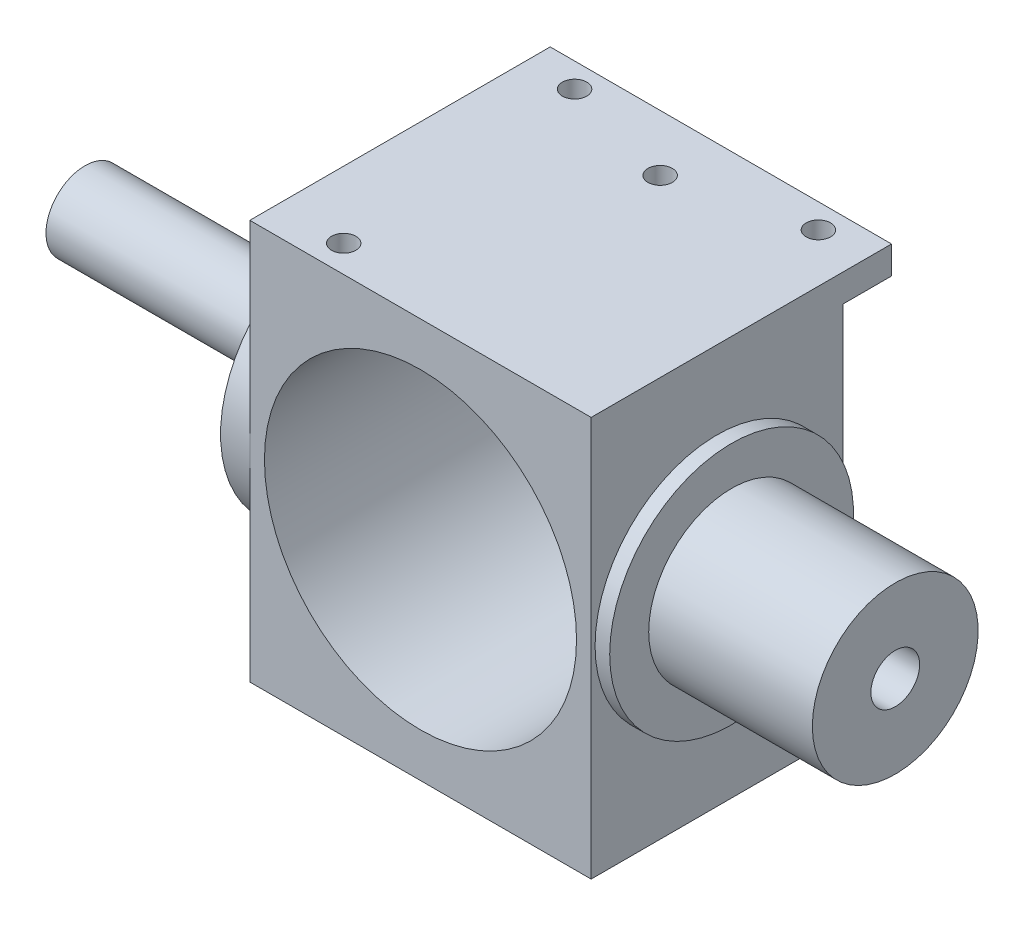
SolidWorks part; units mm, degrees
ref_plane "Front Plane" through (0, 0, 0) normal (0, 0, 1) x (1, 0, 0)
ref_plane "Top Plane" through (0, 0, 0) normal (0, 1, 0) x (1, 0, 0)
ref_plane "Right Plane" through (0, 0, 0) normal (1, 0, 0) x (0, 0, -1)
ref_plane "Plane3" through (0, 0, 37.7129) normal (0, 0, 1) x (1, 0, 0)
sketch "Sketch19" plane through (0, 0, 37.7129) normal (0, 0, 1) x (1, 0, 0)
  line L0 (-29.5005, 31.6184) -> (-29.5005, 27.6184)
  line L1 (-29.5005, 27.6184) -> (0.2995, 27.6184)
  line L2 (0.2995, 27.6184) -> (0.2995, 40.5184)
  line L3 (0.2995, 40.5184) -> (-2.7005, 40.5184)
  line L4 (-2.7005, 40.5184) -> (-2.7005, 33.1184)
  line L5 (-2.7005, 33.1184) -> (-4.2005, 31.6184)
  line L6 (-4.2005, 31.6184) -> (-29.5005, 31.6184)
  line L7 (-29.5005, 27.6184) -> (0.2995, 27.6184) construction
revolve "Revolve2" add sketch "Sketch19" angle 360 about L1
ref_plane "Plane4" through (0, 0, 19.8129) normal (0, 0, -1) x (-1, 0, 0)
sketch "Sketch24" plane through (0, 0, 19.8129) normal (0, 0, -1) x (-1, 0, 0)
  line L0 (-0.2995, 48.1184) -> (-35.2995, 48.1184)
  line L1 (-35.2995, 48.1184) -> (-35.2995, 7.1184)
  line L2 (-35.2995, 7.1184) -> (-0.2995, 7.1184)
  line L3 (-0.2995, 7.1184) -> (-0.2995, 48.1184)
extrude "Boss-Extrude2" add sketch "Sketch24" against normal blind 30.8 separate body
ref_plane "Plane5" through (35.2995, 0, 0) normal (1, 0, 0) x (0, 0, -1)
sketch "Sketch30" plane through (35.2995, 0, 0) normal (1, 0, 0) x (0, 0, -1)
  line L0 (-19.8129, 10.1184) -> (-19.8129, 45.272)
  line L1 (-19.8129, 45.272) -> (-24.8129, 45.272)
  line L2 (-24.8129, 45.272) -> (-24.8129, 10.1184)
  line L3 (-24.8129, 10.1184) -> (-19.8129, 10.1184)
extrude "Cut-Extrude2" cut sketch "Sketch30" against normal through all
ref_plane "Plane6" through (0, 0, 37.7129) normal (0, 0, -1) x (-1, 0, 0)
sketch "Sketch37" plane through (0, 0, 37.7129) normal (0, 0, -1) x (-1, 0, 0)
  line L0 (-53.5807, 36.1184) -> (-53.5807, 27.6184)
  line L1 (-53.5807, 27.6184) -> (-35.2995, 27.6184)
  line L2 (-35.2995, 27.6184) -> (-35.2995, 40.1184)
  line L3 (-35.2995, 40.1184) -> (-36.7995, 40.1184)
  line L4 (-36.7995, 40.1184) -> (-36.7995, 36.1184)
  line L5 (-36.7995, 36.1184) -> (-53.5807, 36.1184)
  line L6 (-53.5807, 27.6184) -> (-35.2995, 27.6184) construction
revolve "Revolve3" add sketch "Sketch37" angle 360 about L1
hole_wizard "Hole2" positions "Sketch39" profile "Sketch38" legacy
sketch "Sketch39" plane through (0, 0, 50.6129) normal (0, 0, 1) x (1, 0, 0)
  point P0 (17.7995, 27.6184)
sketch "Sketch38" plane through (17.7995, 27.6184, 50.6129) normal (1, 0, 0) x (0, -1, 0)
  line L0 (0, 0) -> (0, 30.8)
  line L1 (0, 30.8) -> (16, 30.8)
  line L2 (16, 30.8) -> (16, 0)
  line L3 (16, 0) -> (0, 0)
  line L4 (0, 110) -> (0, -10) construction
  dimension "Diameter" = 32
  dimension "Depth" = 30.8
hole_wizard "#10 Clearance Hole2" positions "Sketch41" profile "Sketch40" hole size "#10" standard "ANSI Inch"
sketch "Sketch41" plane through (53.5807, 0, 0) normal (1, 0, 0) x (0, 0, -1)
  point P0 (-37.7129, 27.6184)
sketch "Sketch40" plane through (53.5807, 27.6184, 37.7129) normal (0, 1, 0) x (0, 0, -1)
  line L0 (0, 0) -> (0, 83.0812)
  line L1 (0, 83.0812) -> (2.5, 83.0812)
  line L2 (2.5, 83.0812) -> (2.5, 0)
  line L5 (2.5, 0) -> (0, 0)
  line L11 (0, -6.35) -> (0, 107.95) construction
  dimension "Thru Hole Dia." = 5
  dimension "Thru Hole Depth" = 83.0812
hole_wizard "#2 Clearance Hole5" positions "Sketch43" profile "Sketch42" hole size "#2" standard "ANSI Inch"
sketch "Sketch43" plane through (0, 48.1184, 0) normal (0, 1, 0) x (1, 0, 0)
  point P0 (7.1495, -47.8379)
sketch "Sketch42" plane through (7.1495, 48.1184, 47.8379) normal (1, 0, 0) x (0, 0, 1)
  line L0 (0, 0) -> (0, 20.5)
  line L1 (0, 20.5) -> (1.25, 20.5)
  line L2 (1.25, 20.5) -> (1.25, 0)
  line L5 (1.25, 0) -> (0, 0)
  line L11 (0, -6.35) -> (0, 107.95) construction
  dimension "Thru Hole Dia." = 2.5
  dimension "Thru Hole Depth" = 20.5
hole_wizard "#2 Clearance Hole6" positions "Sketch45" profile "Sketch44" hole size "#2" standard "ANSI Inch"
sketch "Sketch45" plane through (0, 48.1184, 0) normal (0, 1, 0) x (1, 0, 0)
  point P0 (17.3495, -25.5879)
sketch "Sketch44" plane through (17.3495, 48.1184, 25.5879) normal (1, 0, 0) x (0, 0, 1)
  line L0 (0, 0) -> (0, 20.5)
  line L1 (0, 20.5) -> (1.25, 20.5)
  line L2 (1.25, 20.5) -> (1.25, 0)
  line L5 (1.25, 0) -> (0, 0)
  line L11 (0, -6.35) -> (0, 107.95) construction
  dimension "Thru Hole Dia." = 2.5
  dimension "Thru Hole Depth" = 20.5
hole_wizard "#2 Clearance Hole7" positions "Sketch47" profile "Sketch46" hole size "#2" standard "ANSI Inch"
sketch "Sketch47" plane through (0, 45.272, 0) normal (0, -1, 0) x (-1, 0, 0)
  point P0 (-5.2995, -22.3129)
  point P1 (-30.2995, -22.3129)
sketch "Sketch46" plane through (5.2995, 45.272, 22.3129) normal (1, 0, 0) x (0, 0, -1)
  line L0 (0, 0) -> (0, 2.8464)
  line L1 (0, 2.8464) -> (1.25, 2.8464)
  line L2 (1.25, 2.8464) -> (1.25, 0)
  line L5 (1.25, 0) -> (0, 0)
  line L11 (0, -6.35) -> (0, 107.95) construction
  dimension "Thru Hole Dia." = 2.5
  dimension "Thru Hole Depth" = 2.8464
hole_wizard "#2 Clearance Hole8" positions "Sketch49" profile "Sketch48" hole size "#2" standard "ANSI Inch"
sketch "Sketch49" plane through (0, 10.1184, 0) normal (0, 1, 0) x (1, 0, 0)
  point P0 (5.2995, -22.3129)
  point P1 (30.2995, -22.3129)
sketch "Sketch48" plane through (5.2995, 10.1184, 22.3129) normal (1, 0, 0) x (0, 0, 1)
  line L0 (0, 0) -> (0, 3)
  line L1 (0, 3) -> (1.25, 3)
  line L2 (1.25, 3) -> (1.25, 0)
  line L5 (1.25, 0) -> (0, 0)
  line L11 (0, -6.35) -> (0, 107.95) construction
  dimension "Thru Hole Dia." = 2.5
  dimension "Thru Hole Depth" = 3
